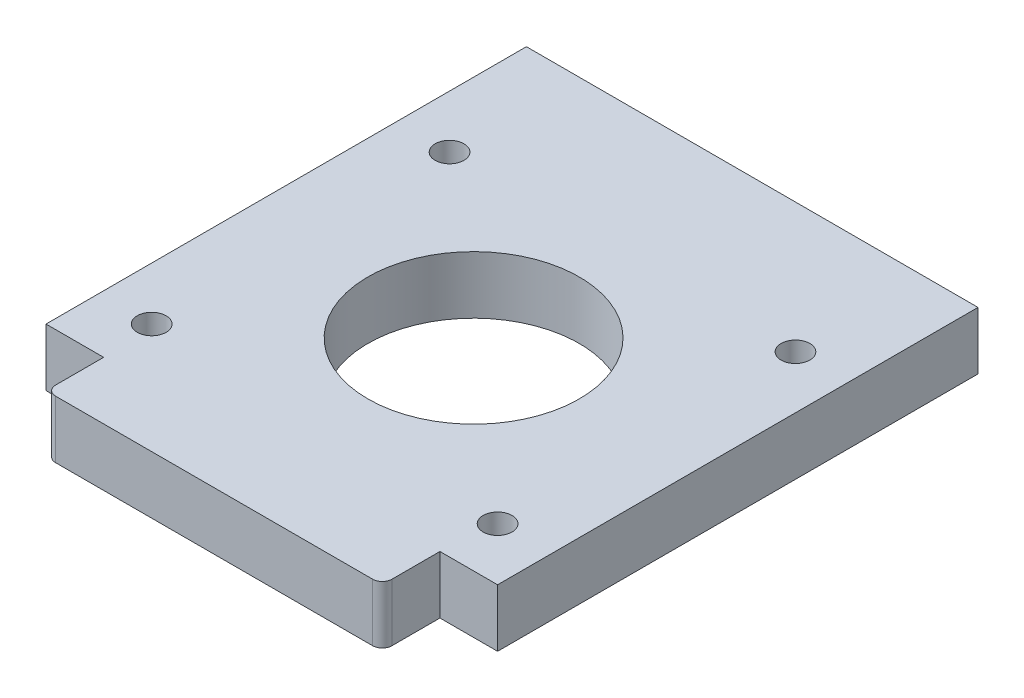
SolidWorks part; units mm, degrees
ref_plane "Front Plane" through (0, 0, 0) normal (0, 0, 1) x (1, 0, 0)
ref_plane "Top Plane" through (0, 0, 0) normal (0, 1, 0) x (1, 0, 0)
ref_plane "Right Plane" through (0, 0, 0) normal (1, 0, 0) x (0, 0, -1)
sketch "Sketch1" plane through (0, 0, 0) normal (0, 1, 0) x (1, 0, 0)
  line L0 (-17.5, -21) -> (-17.5, -27)
  line L2 (-23.5, 21) -> (-23.5, -21)
  line L3 (-23.5, -21) -> (-17.5, -21)
  line L4 (23.5, 21) -> (23.5, -21)
  line L5 (0, 11) -> (0, -27) construction
  line L6 (0, -27) -> (23.5, 0) construction
  line L7 (-17.5, -27) -> (17.5, -27)
  line L8 (17.5, -27) -> (17.5, -21)
  line L9 (17.5, -21) -> (23.5, -21)
  line L10 (23.5, 0) -> (-23.5, 0) construction
  line L11 (-23.5, 21) -> (-23.5, 29)
  line L12 (-23.5, 29) -> (23.5, 29)
  line L13 (23.5, 29) -> (23.5, 21)
  circle A0 centre (0, 0) radius 11
  circle A1 centre (-18, -15.5) radius 1.5
  circle A2 centre (18, -15.5) radius 1.5
  circle A3 centre (18, 15.5) radius 1.5
  circle A4 centre (-18, 15.5) radius 1.5
  point P0 (0, 0)
  point P10 (-17.5, -24)
  dimension "D2" = 22
  dimension "D3" = 21
  dimension "D7" = 3
  dimension "D9" = 5.5
  dimension "D1" = 47
  dimension "D4" = 6
  dimension "D5" = 6
  dimension "D6" = 6
  dimension "D8" = 5.5
  dimension "D10" = 8
  dimension "D11" = 50
extrude "Boss-Extrude1" add sketch "Sketch1" along normal blind 6
fillet "Fillet1" radius 1 2 edges at (17.5, 3, 27) (-17.5, 3, 27)
